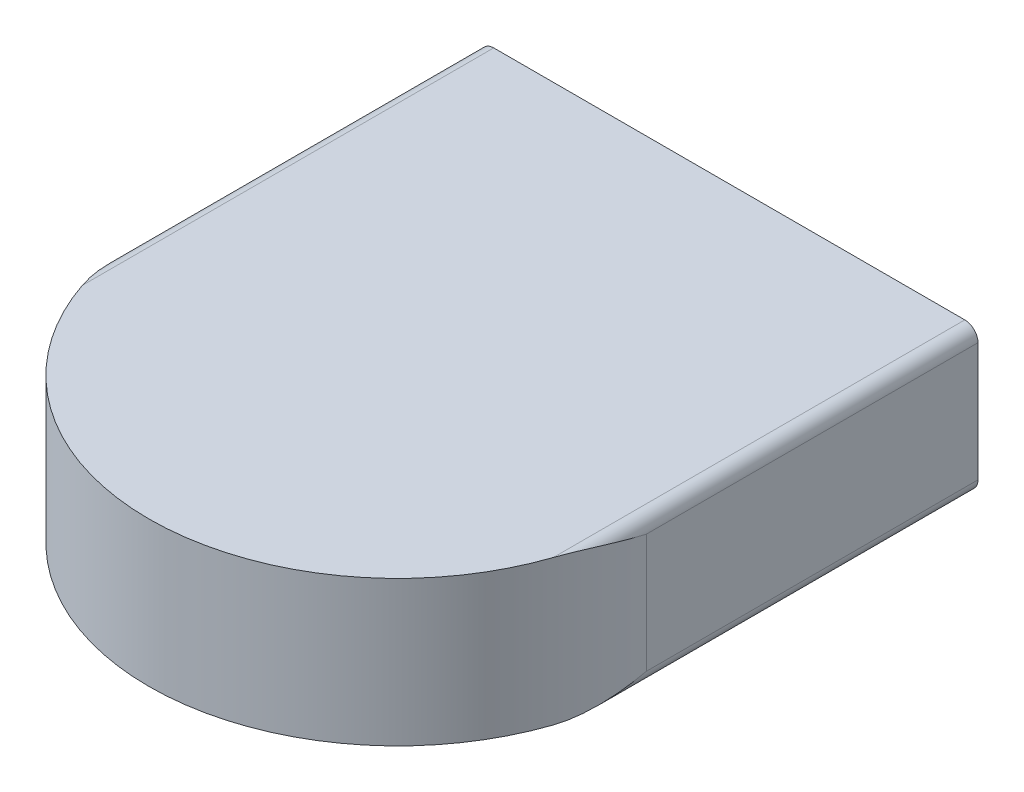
SolidWorks part; units mm, degrees
ref_plane "Front" through (0, 0, 0) normal (0, 0, 1) x (1, 0, 0)
ref_plane "Top" through (0, 0, 0) normal (0, 1, 0) x (1, 0, 0)
ref_plane "Right" through (0, 0, 0) normal (1, 0, 0) x (0, 0, -1)
sketch "Sketch1" plane through (0, 0, 0) normal (0, 1, 0) x (1, 0, 0)
  line L0 (-30, 40) -> (30, 40)
  line L1 (30, 40) -> (30, 0)
  line L2 (-30, 0) -> (-30, 40)
  arc A0 (30, 0) -> (-30, 0) centre (0, 0) cw
  dimension "D1" = 30
  dimension "D2" = 40
extrude "Extrude1" add sketch "Sketch1" along normal mid plane 17.5
sketch "Sketch2" plane through (0, 0, -40) normal (0, 0, -1) x (-1, 0, 0)
  line L1 (-28.412, 8.75) -> (28.412, 8.75)
  line L2 (-30, 7.162) -> (-30, -7.162)
  line L3 (-28.412, -8.75) -> (28.412, -8.75)
  line L4 (30, 7.162) -> (30, -7.162)
  arc A0 (-28.412, 8.75) -> (-30, 7.162) centre (-28.412, 7.162) ccw
  arc A1 (-30, -7.162) -> (-28.412, -8.75) centre (-28.412, -7.162) ccw
  arc A2 (28.412, 8.75) -> (30, 7.162) centre (28.412, 7.162) cw
  arc A3 (28.412, -8.75) -> (30, -7.162) centre (28.412, -7.162) ccw
  point P6 (-30, 8.75)
  point P13 (30, -8.75)
  dimension "D1" = 1.588
extrude "Cut-Extrude1" cut sketch "Sketch2" against normal through all flip side to cut
